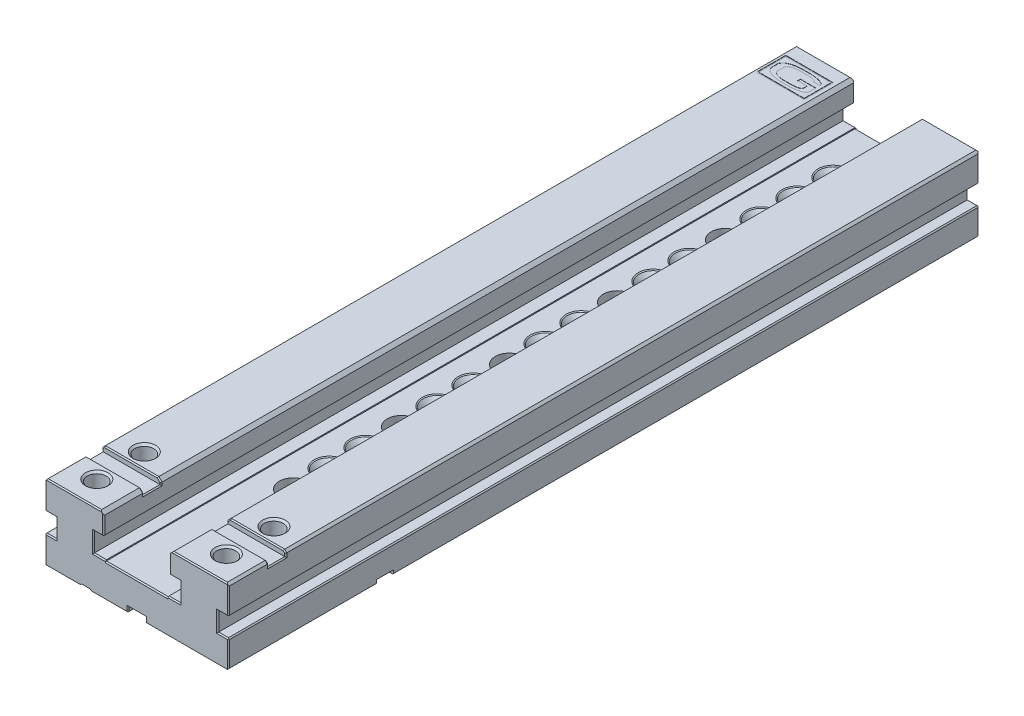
SolidWorks part; units mm, degrees
ref_plane "Front Plane" through (0, 0, 0) normal (0, 0, 1) x (1, 0, 0)
ref_plane "Top Plane" through (0, 0, 0) normal (0, 1, 0) x (1, 0, 0)
ref_plane "Right Plane" through (0, 0, 0) normal (1, 0, 0) x (0, 0, -1)
imported_body "Imported1"
sketch "Sketch1" plane through (0, 31, 0) normal (0, 1, 0) x (1, 0, 0)
  circle A0 centre (0, -550) radius 14.0003
  circle A1 centre (0, -350) radius 14.0003
  circle A2 centre (0, -450) radius 14.0209
extrude "Boss-Extrude1" add sketch "Sketch1" against normal up to surface (25 mm away)
sketch "Sketch2" plane through (0, 31, 0) normal (0, 1, 0) x (1, 0, 0)
  circle A0 centre (0, -249.3447) radius 15.2883
  circle A1 centre (0, -150) radius 14.0002
extrude "Boss-Extrude2" add sketch "Sketch2" against normal up to surface (31 mm away)
hole_wizard "Hole1" positions "Sketch4" profile "Sketch3" legacy
sketch "Sketch4" plane through (0, 31, 0) normal (0, 1, 0) x (1, 0, 0)
  line L0 (84, -695) -> (32.5, -695) construction
  point P0 (0, -450)
  point P5 (0, -250)
  dimension "D1" = 245
  dimension "D2" = 200
sketch "Sketch3" plane through (0, 31, 450) normal (1, 0, 0) x (0, 0, 1)
  line L0 (0, 0) -> (0, 100)
  line L1 (0, 100) -> (8, 100)
  line L2 (8, 100) -> (8, 11)
  line L3 (8, 11) -> (13, 11)
  line L4 (13, 11) -> (13, 0)
  line L5 (13, 0) -> (0, 0)
  line L6 (0, 110) -> (0, -10) construction
  dimension "Diameter" = 16
  dimension "Depth" = 100
  dimension "C-Bore Diameter" = 26
  dimension "C-Bore Depth" = 11
hole_wizard "Hole2" positions "Sketch6" profile "Sketch5" legacy
sketch "Sketch6" plane through (0, 31, 0) normal (0, 1, 0) x (1, 0, 0)
  line L0 (29, -695) -> (-29, -695) construction
  circle A0 centre (0, -450) radius 13 construction
  point P0 (0, -550)
  point P2 (0, -350)
  point P25 (0, -150)
  dimension "D1" = 100
  dimension "D2" = 200
  dimension "D3" = 145
  dimension "D4" = 200
sketch "Sketch5" plane through (0, 31, 550) normal (1, 0, 0) x (0, 0, 1)
  line L0 (0, 0) -> (0, 100)
  line L1 (0, 100) -> (8.5, 100)
  line L2 (8.5, 100) -> (8.5, 17)
  line L3 (8.5, 17) -> (13, 17)
  line L4 (13, 17) -> (13, 0)
  line L5 (13, 0) -> (0, 0)
  line L6 (0, 110) -> (0, -10) construction
  dimension "Diameter" = 17
  dimension "Depth" = 100
  dimension "C-Bore Diameter" = 26
  dimension "C-Bore Depth" = 17
